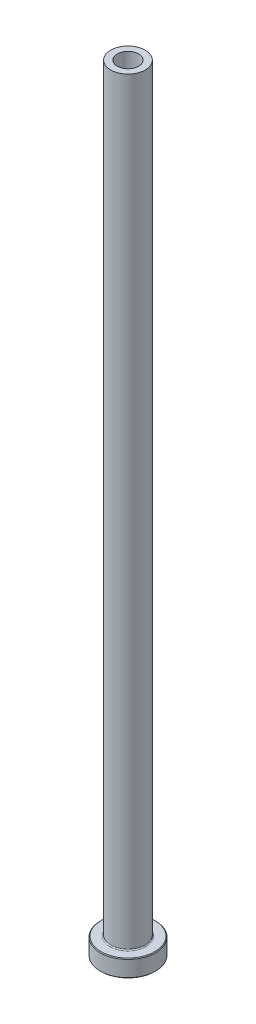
SolidWorks part; units mm, degrees
ref_plane "Front Plane" through (0, 0, 0) normal (0, 0, 1) x (1, 0, 0)
ref_plane "Top Plane" through (0, 0, 0) normal (0, 1, 0) x (1, 0, 0)
ref_plane "Right Plane" through (0, 0, 0) normal (1, 0, 0) x (0, 0, -1)
sketch "Sketch1" plane through (0, 0, 0) normal (0, 0, 1) x (1, 0, 0)
  line L0 (-3.1, 225) -> (-5, 225)
  line L1 (-5, 225) -> (-5, 5)
  line L2 (-5, 5) -> (-8, 5)
  line L3 (-8, 5) -> (-8, 0)
  line L4 (8.8, 0) -> (-8.8, 0) construction
  line L5 (-8, 0) -> (-3.35, 0)
  line L6 (-3.1, 180) -> (-3.1, 225)
  line L7 (0, 92.1877) -> (0, -15.5353) construction
  line L8 (0, -8.8) -> (0, 8.8) construction
  line L9 (-3.1, 180) -> (-3.35, 168)
  line L10 (-3.35, 168) -> (-3.35, 0)
  dimension "D1" = 0.25
  dimension "ID" = 6.2
  dimension "OD" = 10
  dimension "L" = 225
  dimension "H" = 16
  dimension "T" = 5
  dimension "N" = 45
  dimension "D2" = 12
revolve "Revolve1" add sketch "Sketch1" angle 360 about L7
fillet "Fillet1" radius 0.3 1 edges at (0, 5, 5)
chamfer "Chamfer1" distance 0.2 angle 45 2 edges at (0, 5, 8) (0, 0, 8)
chamfer "Chamfer3" distance 0.5 angle 45 1 edges at (0, 0, 3.35)
